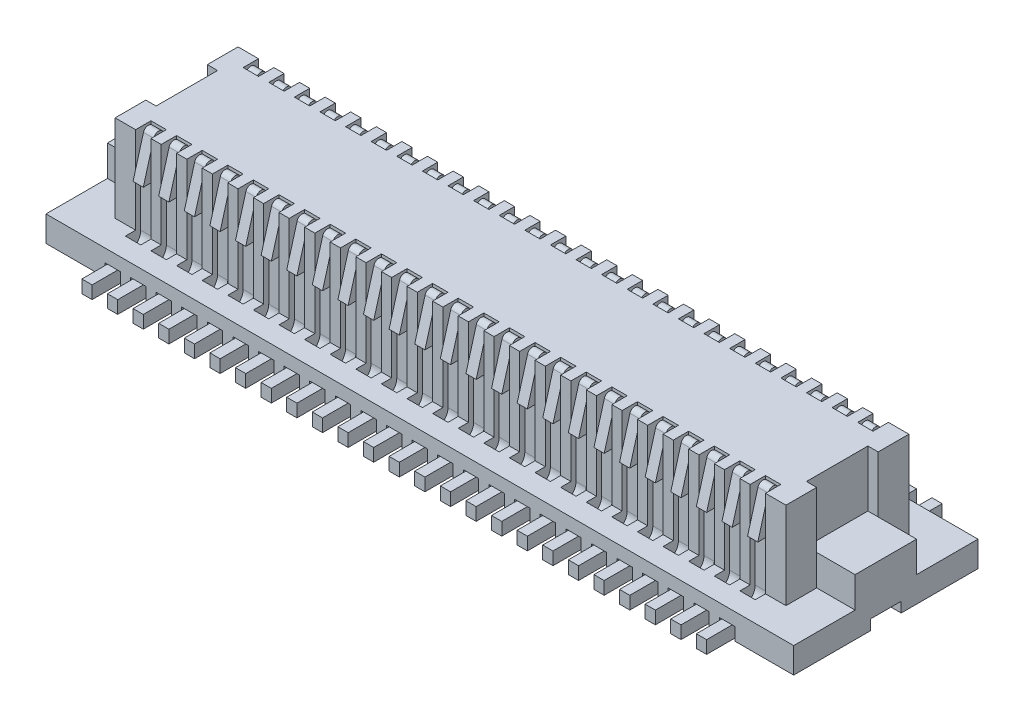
SolidWorks part; units mm, degrees
ref_plane "Front" through (0, 0, 0) normal (0, 0, 1) x (1, 0, 0)
ref_plane "Top" through (0, 0, 0) normal (0, 1, 0) x (1, 0, 0)
ref_plane "Right" through (0, 0, 0) normal (1, 0, 0) x (0, 0, -1)
sketch "Эскиз1" plane through (0, 0, 0) normal (1, 0, 0) x (0, 0, -1)
  line L0 (-0.3, 0) -> (-0.3, 0.2)
  line L1 (-0.3, 0.2) -> (0.3, 0.2)
  line L2 (0, 0) -> (0, 0.2) construction
  line L3 (-0.3, 0) -> (-1.8, 0)
  line L4 (-1.8, 0) -> (-1.8, 0.5)
  line L5 (-1.8, 0.5) -> (-0.6, 0.5)
  line L6 (1.8, 0) -> (1.8, 0.5)
  line L7 (0.3, 0) -> (1.8, 0)
  line L8 (0.3, 0) -> (0.3, 0.2)
  line L9 (0.6, 0.5) -> (1.8, 0.5)
  line L11 (-0.6, 0.5) -> (-0.6, 1.1)
  line L12 (-0.6, 1.1) -> (0.6, 1.1)
  line L13 (0.6, 0.5) -> (0.6, 1.1)
  dimension "D1" = 3.6
  dimension "D2" = 1.1
  dimension "D3" = 0.5
  dimension "D4" = 1.2
  dimension "D5" = 0.6
  dimension "D6" = 0.2
extrude "Вытянуть1" add sketch "Эскиз1" along normal mid plane 14.6
sketch "Эскиз2" plane through (0, 0.5, 0) normal (0, 1, 0) x (-1, 0, 0)
  line L0 (0, 0) -> (-7.3, 0) construction
  line L1 (6.55, 1.2) -> (-6.55, 1.2)
  line L2 (6.55, 1.2) -> (6.55, 0.6)
  line L3 (6.55, -1.2) -> (-6.55, -1.2)
  line L4 (-6.55, 1.2) -> (-6.55, 0.6)
  line L5 (-7.3, -0.6) -> (-7.3, 0.6) construction
  line L6 (0, -1.8) -> (0, 1.8) construction
  line L7 (-7.3, -1.8) -> (7.3, -1.8) construction
  line L8 (-7.3, 1.8) -> (7.3, 1.8) construction
  line L9 (-7.3, 0.6) -> (7.3, 0.6) construction
  line L10 (6.55, 0.6) -> (6.35, 0.6)
  line L11 (-6.35, 0.6) -> (-6.35, -0.6)
  line L12 (6.55, -0.6) -> (6.35, -0.6)
  line L13 (6.35, 0.6) -> (6.35, -0.6)
  line L14 (-7.3, -0.6) -> (7.3, -0.6) construction
  line L15 (6.55, -0.6) -> (6.55, -1.2)
  line L16 (-6.55, -0.6) -> (-6.35, -0.6)
  line L17 (-6.55, 0.6) -> (-6.35, 0.6)
  line L18 (-6.55, -0.6) -> (-6.55, -1.2)
  dimension "D1" = 2.4
  dimension "D2" = 13.1
  dimension "D3" = 0.2
extrude "Вытянуть3" add sketch "Эскиз2" along normal offset from surface (1.7 mm away) 2.2
ref_plane "Плоскость1" through (-6, 0, 0) normal (1, 0, 0) x (0, 0, -1)
sketch "Эскиз4" plane through (-6, 0, 0) normal (1, 0, 0) x (0, 0, -1)
  line L0 (-0.9, 2.2) -> (-0.9, 0)
  line L1 (-0.6, 2.2) -> (-1.2, 2.2) construction
  line L2 (-1.8, 0) -> (-0.3, 0) construction
  line L3 (-0.9, 0) -> (-1.8, 0)
  line L4 (-1.8, 0) -> (-1.8, 0.25)
  line L5 (-1.8, 0.5) -> (-1.8, 0) construction
  line L6 (-1.8, 0.25) -> (-1.4, 0.25)
  line L7 (-1.4, 0.25) -> (-1.4, 2.2)
  line L8 (-1.4, 2.2) -> (-0.9, 2.2)
  line L9 (0, 0) -> (0, 2.2) construction
  line L10 (0.6, 2.2) -> (-0.6, 2.2) construction
  line L11 (1.4, 2.2) -> (0.9, 2.2)
  line L12 (1.4, 0.25) -> (1.4, 2.2)
  line L13 (1.8, 0.25) -> (1.4, 0.25)
  line L14 (1.8, 0) -> (1.8, 0.25)
  line L15 (0.9, 0) -> (1.8, 0)
  line L16 (0.9, 2.2) -> (0.9, 0)
  dimension "D1" = 0.25
  dimension "D2" = 0.5
extrude "Вырез-Вытянуть1" cut sketch "Эскиз4" against normal mid plane 0.3
sketch "Эскиз5" plane through (-6, 0, 0) normal (1, 0, 0) x (0, 0, -1)
  line L0 (-0.9, 2.1) -> (-0.9, 0.5)
  line L1 (-1.4, 0) -> (-2.3, 0)
  line L2 (-2.3, 0) -> (-2.3, 0.25)
  line L3 (-2.3, 0.25) -> (-1.4, 0.25)
  line L4 (-1.15, 0.5) -> (-1.15, 1.4)
  line L5 (-1.15, 1.4) -> (-1.3, 1.4)
  line L6 (-1.3, 1.4) -> (-1.0963, 2.127)
  line L7 (-1.4, 2.2) -> (-0.9, 2.2) construction
  line L8 (0, 2.2) -> (0, 0) construction
  line L9 (-0.6, 2.2) -> (-1.2, 2.2) construction
  line L10 (1.3, 1.4) -> (1.0963, 2.127)
  line L11 (1.15, 1.4) -> (1.3, 1.4)
  line L12 (1.15, 0.5) -> (1.15, 1.4)
  line L13 (2.3, 0.25) -> (1.4, 0.25)
  line L14 (2.3, 0) -> (2.3, 0.25)
  line L15 (1.4, 0) -> (2.3, 0)
  line L16 (0.9, 2.1) -> (0.9, 0.5)
  line L17 (-0.9, 0) -> (-1.8, 0) construction
  arc A0 (-1.0963, 2.127) -> (-0.9, 2.1) centre (-1, 2.1) cw
  arc A1 (0.9, 0.5) -> (1.4, 0) centre (1.4, 0.5) ccw
  arc A2 (-1.4, 0.25) -> (-1.15, 0.5) centre (-1.4, 0.5) ccw
  arc A3 (-0.9, 0.5) -> (-1.4, 0) centre (-1.4, 0.5) cw
  arc A4 (1.4, 0.25) -> (1.15, 0.5) centre (1.4, 0.5) cw
  arc A5 (1.0963, 2.127) -> (0.9, 2.1) centre (1, 2.1) ccw
  point P28 (-1.15, 0.25)
  point P31 (-0.9, 0)
  dimension "D4" = 0.25
  dimension "D8" = 0.1
  dimension "D1" = 0.25
  dimension "D3" = 4.6
  dimension "D6" = 0.4
  dimension "D7" = 0.8
extrude "Вытянуть4" add sketch "Эскиз5" along normal mid plane 0.2
pattern_linear "Линейный массив1" count 25 spacing 0.5 along (1, 0, 0) of "Вырез-Вытянуть1", "Вытянуть4"
